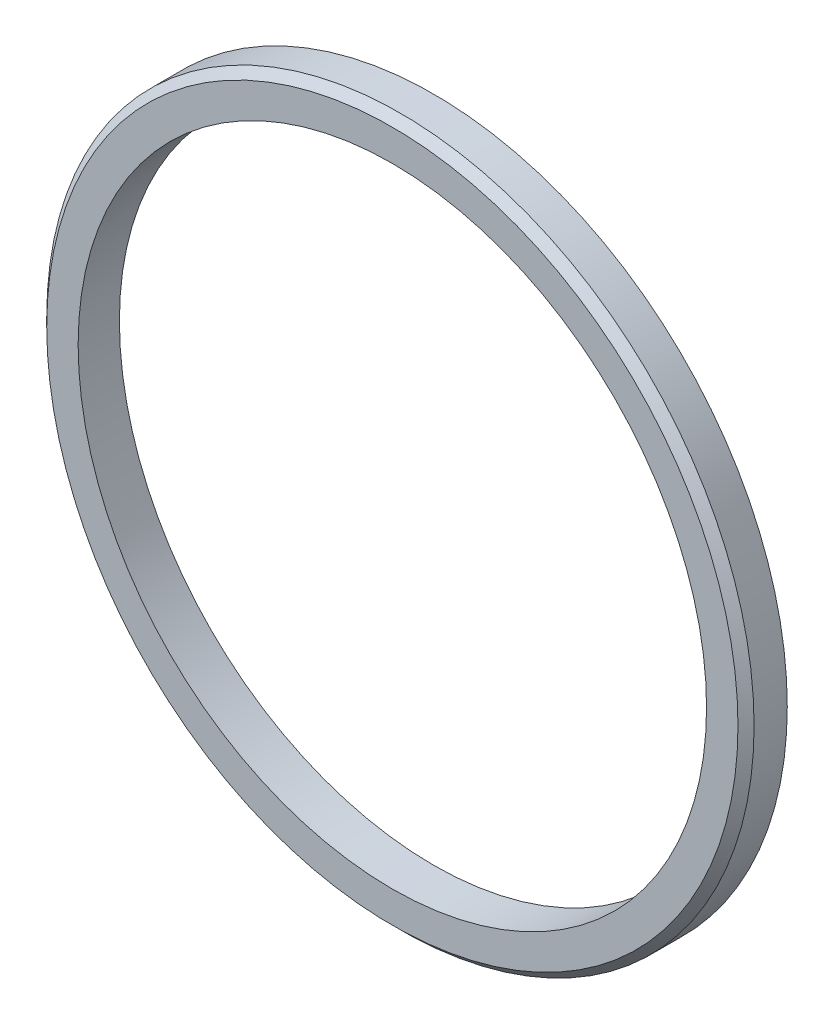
SolidWorks part; units mm, degrees
ref_plane "Front Plane" through (0, 0, 0) normal (0, 0, 1) x (1, 0, 0)
ref_plane "Top Plane" through (0, 0, 0) normal (0, 1, 0) x (1, 0, 0)
ref_plane "Right Plane" through (0, 0, 0) normal (1, 0, 0) x (0, 0, -1)
sketch "Sketch1" plane through (0, 0, 0) normal (0, 0, 1) x (1, 0, 0)
  circle A0 centre (0, 0) radius 9.75
  circle A1 centre (0, 0) radius 10.975
  dimension "D1" = 19.5
  dimension "D2" = 21.95
extrude "Boss-Extrude1" add sketch "Sketch1" along normal blind 1.28
chamfer "Chamfer1" distance 0.25 angle 45 1 edges at (10.975, 0, 1.28)
